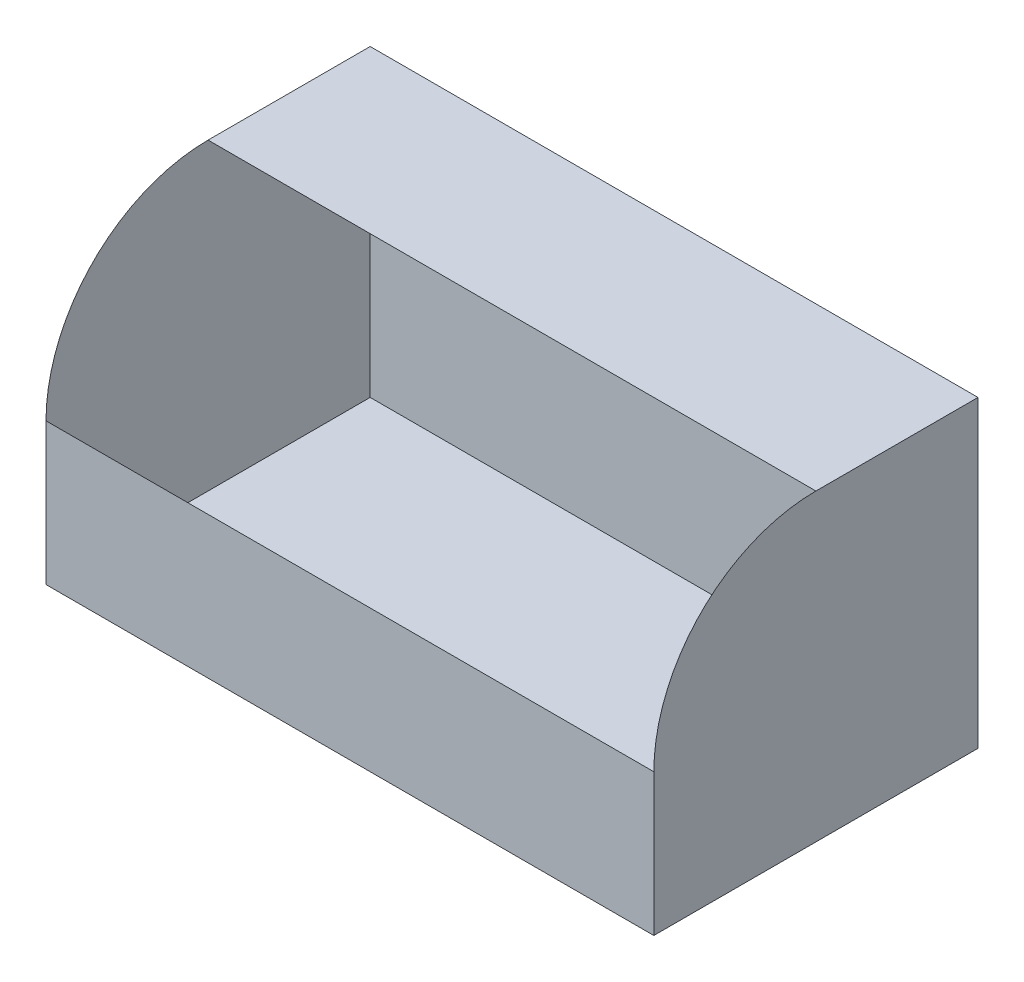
SolidWorks part; units mm, degrees
ref_plane "Front" through (0, 0, 0) normal (0, 0, 1) x (1, 0, 0)
ref_plane "Top" through (0, 0, 0) normal (0, 1, 0) x (1, 0, 0)
ref_plane "Right" through (0, 0, 0) normal (1, 0, 0) x (0, 0, -1)
sketch "Sketch1" plane through (0, 0, 0) normal (0, 0, 1) x (1, 0, 0)
  line L0 (75, -37.5) -> (-75, 37.5) construction
  line L1 (-75, 37.5) -> (75, 37.5)
  line L2 (-75, 37.5) -> (-75, -37.5)
  line L3 (-75, -37.5) -> (75, -37.5)
  line L4 (75, 37.5) -> (75, -37.5)
  dimension "D1" = 150
  dimension "D2" = 75
extrude "Extrude1" add sketch "Sketch1" along normal mid plane 80
fillet "Fillet1" radius 40 1 edges at (0, 37.5, 40)
other "DeleteFace2"
